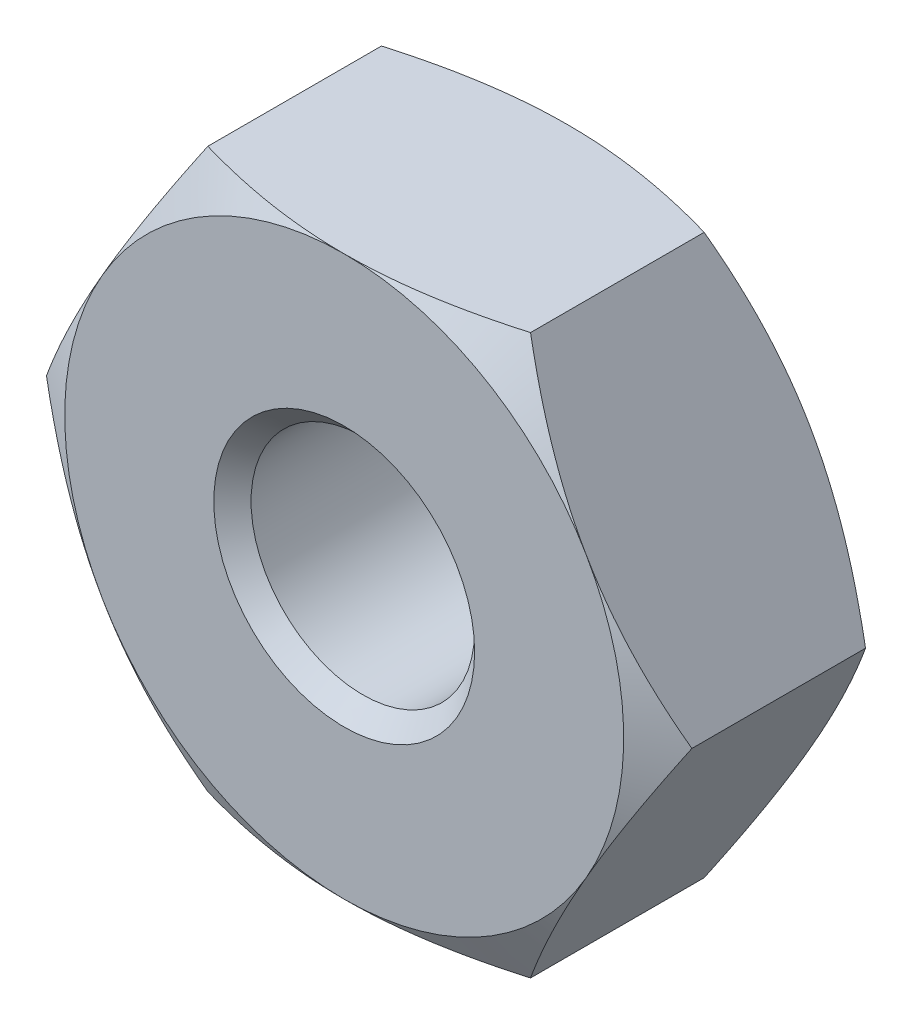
SolidWorks part; units mm, degrees
ref_plane "Front" through (0, 0, 0) normal (0, 0, 1) x (1, 0, 0)
ref_plane "Top" through (0, 0, 0) normal (0, 1, 0) x (1, 0, 0)
ref_plane "Right" through (0, 0, 0) normal (1, 0, 0) x (0, 0, -1)
sketch "Sketch1" plane through (0, 0, 0) normal (0, 0, 1) x (1, 0, 0)
  line L1 (0.866, -1.5) -> (1.7321, 0)
  line L2 (1.7321, 0) -> (0.866, 1.5)
  line L3 (0.866, 1.5) -> (-0.866, 1.5)
  line L4 (-0.866, 1.5) -> (-1.7321, 0)
  line L5 (-1.7321, 0) -> (-0.866, -1.5)
  line L6 (-0.866, -1.5) -> (0.866, -1.5)
  circle A0 centre (0, 0) radius 1.5 construction
  circle A1 centre (0, 0) radius 0.6
  dimension "xd" = 1.2
  dimension "s" = 3
extrude "BaseNut" add sketch "Sketch1" against normal blind 1.2
sketch "Sketch2" plane through (0.0417, 0, -0.0557) normal (0, 1, 0) x (0, 0, 1)
  line L0 (0.8974, -0.0417) -> (-0.8, -0.0417) construction
  line L2 (-0.5443, 1.9305) -> (-0.5443, -1.9166) construction
  line L3 (-1.1443, 1.4583) -> (-1.0104, 1.6903)
  line L6 (-1.0104, 1.6903) -> (-1.1443, 1.6903)
  line L7 (-1.1443, 1.6903) -> (-1.1443, 1.4583)
  line L8 (0.0557, 1.6903) -> (0.0557, 1.4583)
  line L9 (-0.0783, 1.6903) -> (0.0557, 1.6903)
  line L10 (0.0557, 1.4583) -> (-0.0783, 1.6903)
  line L11 (-1.0443, 0.5583) -> (-1.1443, 0.6583)
  line L14 (-1.1443, 0.6583) -> (-1.1443, 0.5583)
  line L15 (-1.1443, 0.5583) -> (-1.0443, 0.5583)
  line L16 (0.0557, 0.5583) -> (-0.0443, 0.5583)
  line L17 (0.0557, 0.6583) -> (0.0557, 0.5583)
  line L18 (-0.0443, 0.5583) -> (0.0557, 0.6583)
  dimension "D1" = 30
  dimension "D2" = 3
  dimension "da" = 1.4
  dimension "D4" = 45
revolve "Double-Chamfer" cut sketch "Sketch2" angle 360 about L0
sketch "Sketch3" plane through (0, 0, 0) normal (0, 1, 0) x (1, 0, 0)
  line L0 (-0.6866, 1.1) -> (-0.6, 1.05)
  line L1 (-0.6, 1.05) -> (-0.5, 1.05)
  line L2 (-0.5, 1.05) -> (-0.5, 1.15)
  line L3 (-0.5, 1.15) -> (-0.6, 1.15)
  line L4 (-0.6, 1.15) -> (-0.6866, 1.1)
  line L6 (0, 0) -> (0, 2.4604) construction
  dimension "D1" = 0.1
  dimension "D2" = 1.2
revolve "Cut-Revolve10" [suppressed] cut sketch "Sketch3" angle 360 about L6
pattern_linear "LPattern10" [suppressed] count 10 along (0, 0, -1)
equation "\"D2@Sketch2\" = \"s@Sketch1\""
equation "\"D2@Sketch3\"=\"xd@Sketch1\""
equation "\"D1@Sketch3\"= ( \"D2@ThreadCosmetic1\"-\"D2@Sketch3\" )  / 2"
equation "\"H@LPattern10\"=\"D1@Sketch3\" * 1.2"
equation "\"D1@LPattern10\"=\"m@BaseNut\" / \"H@LPattern10\""
